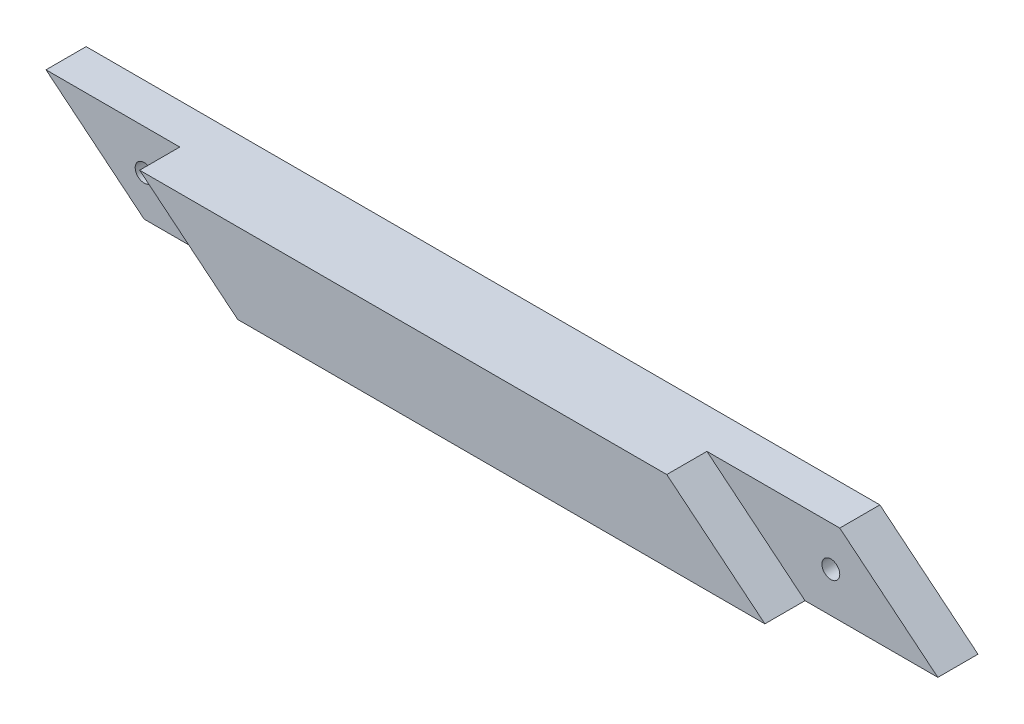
SolidWorks part; units mm, degrees
ref_plane "Plan de face" through (0, 0, 0) normal (0, 0, 1) x (1, 0, 0)
ref_plane "Plan de dessus" through (0, 0, 0) normal (0, 1, 0) x (1, 0, 0)
ref_plane "Plan de droite" through (0, 0, 0) normal (1, 0, 0) x (0, 0, -1)
sketch "Esquisse1" plane through (0, 0, 0) normal (0, 0, 1) x (1, 0, 0)
  line L1 (0, 0) -> (100, 0)
  line L2 (0, 0) -> (0, 9)
  line L3 (0, 9) -> (100, 9)
  line L4 (100, 0) -> (100, 9)
  dimension "D1" = 100
  dimension "D2" = 9
extrude "Extrusion1" add sketch "Esquisse1" along normal blind 9
sketch "Esquisse2" plane through (0, 0, 9) normal (0, 0, 1) x (1, 0, 0)
  line L0 (0, 9) -> (11, 0)
  line L1 (0, 0) -> (100, 0) construction
  line L2 (11, 0) -> (0, 0)
  line L3 (0, 0) -> (0, 9)
  dimension "D1" = 11
extrude "Enlèv. mat.-Extru.1" cut sketch "Esquisse2" against normal blind 9
sketch "Esquisse3" plane through (0, 0, 9) normal (0, 0, 1) x (1, 0, 0)
  line L0 (0, 9) -> (15, 9)
  line L1 (100, 9) -> (0, 9) construction
  line L2 (15, 9) -> (26, 0)
  line L3 (11, 0) -> (100, 0) construction
  line L4 (26, 0) -> (11, 0)
  line L5 (11, 0) -> (0, 9)
  dimension "D1" = 15
  dimension "D2" = 15
extrude "Enlèv. mat.-Extru.2" cut sketch "Esquisse3" against normal blind 4.5
sketch "Esquisse4" plane through (0, 0, 4.5) normal (0, 0, 1) x (1, 0, 0)
  line L0 (100, 0) -> (100, 9) construction
  line L1 (15, 9) -> (0, 9) construction
  circle A0 centre (11, 4.5) radius 1
  dimension "D3" = 2
  dimension "D1" = 89
  dimension "D2" = 4.5
extrude "Enlèv. mat.-Extru.3" cut sketch "Esquisse4" against normal blind 4.5
sketch "Esquisse5" plane through (0, 0, 9) normal (0, 0, 1) x (1, 0, 0)
  line L0 (100, 0) -> (100, 9)
  line L1 (100, 9) -> (89, 9)
  line L2 (100, 9) -> (15, 9) construction
  line L3 (89, 9) -> (100, 0)
  dimension "D1" = 11
extrude "Enlèv. mat.-Extru.4" cut sketch "Esquisse5" against normal blind 9
sketch "Esquisse6" plane through (0, 0, 9) normal (0, 0, 1) x (1, 0, 0)
  line L0 (89, 9) -> (74.1045, 9)
  line L1 (89, 9) -> (15, 9) construction
  line L2 (74.1045, 9) -> (85.1045, 0)
  line L3 (26, 0) -> (100, 0) construction
  line L4 (85.1045, 0) -> (100, 0)
  line L5 (100, 0) -> (89, 9)
extrude "Enlèv. mat.-Extru.5" cut sketch "Esquisse6" against normal blind 4.5
sketch "Esquisse7" plane through (0, 0, 4.5) normal (0, 0, 1) x (1, 0, 0)
  line L0 (85.1045, 0) -> (100, 0) construction
  circle A0 centre (88, 4.5) radius 1
  circle A1 centre (11, 4.5) radius 1 construction
  dimension "D3" = 2
  dimension "D1" = 77
  dimension "D2" = 4.5
extrude "Enlèv. mat.-Extru.6" cut sketch "Esquisse7" against normal blind 4.5
